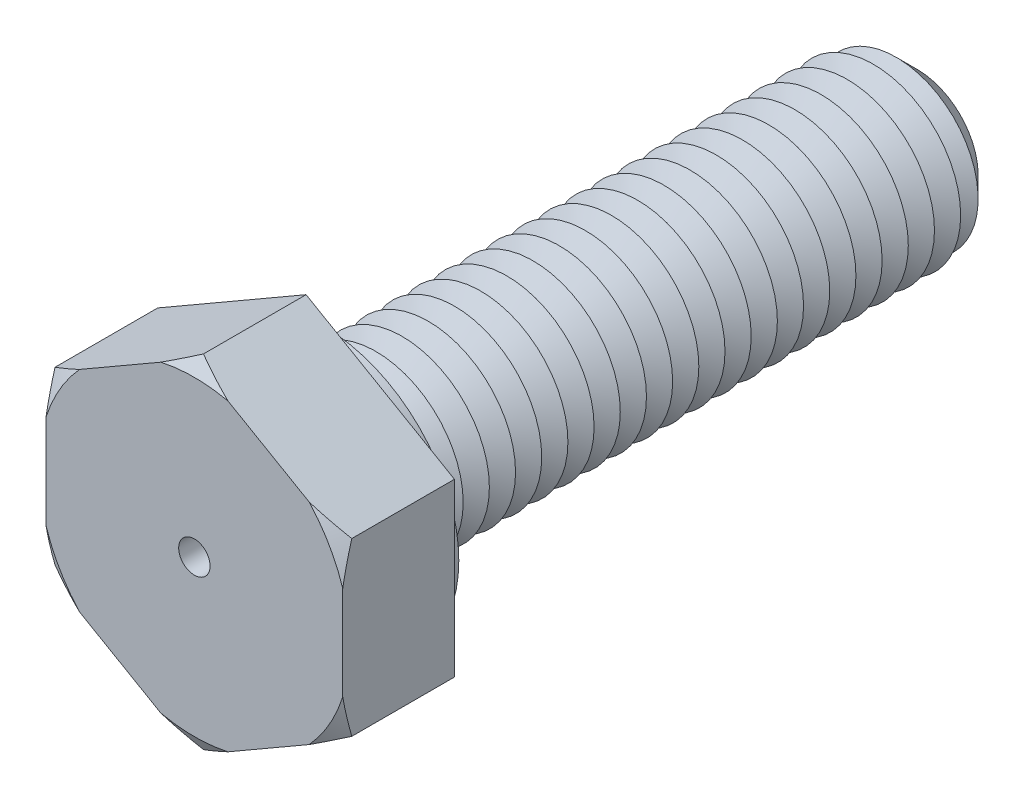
SolidWorks part; units mm, degrees
ref_plane "Front Plane" through (0, 0, 0) normal (0, 0, 1) x (1, 0, 0)
ref_plane "Top Plane" through (0, 0, 0) normal (0, 1, 0) x (1, 0, 0)
ref_plane "Right Plane" through (0, 0, 0) normal (1, 0, 0) x (0, 0, -1)
sketch "Sketch2" plane through (0, 0, 0) normal (0, 0, 1) x (1, 0, 0)
  line L1 (0, 9.815) -> (-8.5, 4.9075)
  line L2 (-8.5, 4.9075) -> (-8.5, -4.9075)
  line L3 (-8.5, -4.9075) -> (0, -9.815)
  line L4 (0, -9.815) -> (8.5, -4.9075)
  line L5 (8.5, -4.9075) -> (8.5, 4.9075)
  line L6 (8.5, 4.9075) -> (0, 9.815)
  circle A0 centre (0, 0) radius 8.5 construction
  dimension "D1" = 17
extrude "Boss-Extrude1" add sketch "Sketch2" along normal blind 6.4
sketch "Sketch3" plane through (0, 0, 0) normal (0, 0, -1) x (-1, 0, 0)
  circle A0 centre (0, 0) radius 5
  dimension "D1" = 10
extrude "Boss-Extrude2" add sketch "Sketch3" along normal blind 35
sketch "Sketch4" plane through (0, 0, 0) normal (0, 0, -1) x (-1, 0, 0)
  circle A0 centre (0, 0) radius 7.75
  dimension "D1" = 15.5
extrude "Boss-Extrude3" add sketch "Sketch4" along normal blind 1
sketch "Sketch5" plane through (0, 0, 0) normal (1, 0, 0) x (0, 0, -1)
  line L0 (-3.2117, 0) -> (6.3192, 0) construction
chamfer "Chamfer1" distance 1.5 angle 45 1 edges at (-5, 0, -35)
sketch "Sketch6" plane through (0, 0, 0) normal (1, 0, 0) x (0, 0, -1)
  line L0 (1, 5) -> (1.75, 3.701)
  line L1 (1.75, 3.701) -> (2.5, 5)
  line L2 (33.5, 5) -> (1, 5) construction
  line L3 (2.5, 5) -> (1, 5)
  dimension "D1" = 1.5
revolve "Cut-Revolve1" cut sketch "Sketch6" angle 360 about L0
pattern_linear "LPattern1" count 22 spacing 1.5 along (0, 0, -1) of "Cut-Revolve1"
sketch "Sketch7" plane through (0, 0, 0) normal (1, 0, 0) x (0, 0, -1)
  line L0 (-6.4, 9.815) -> (-6.4, 8.915)
  line L1 (-6.4, 4.9075) -> (-6.4, 9.815) construction
  line L2 (-6.4, 8.915) -> (-5.8804, 9.815)
  line L3 (-6.4, 9.815) -> (0, 9.815) construction
  line L4 (-5.8804, 9.815) -> (-6.4, 9.815)
  dimension "D1" = 0.9
  dimension "D2" = 30
revolve "Cut-Revolve2" cut sketch "Sketch7" angle 360 about L0
sketch "Sketch8" plane through (0, 0, 6.4) normal (0, 0, 1) x (1, 0, 0)
  circle A0 centre (0, 0) radius 0.9
  dimension "D1" = 1.8
extrude "Cut-Extrude1" cut sketch "Sketch8" against normal up to surface (41.4 mm away)
